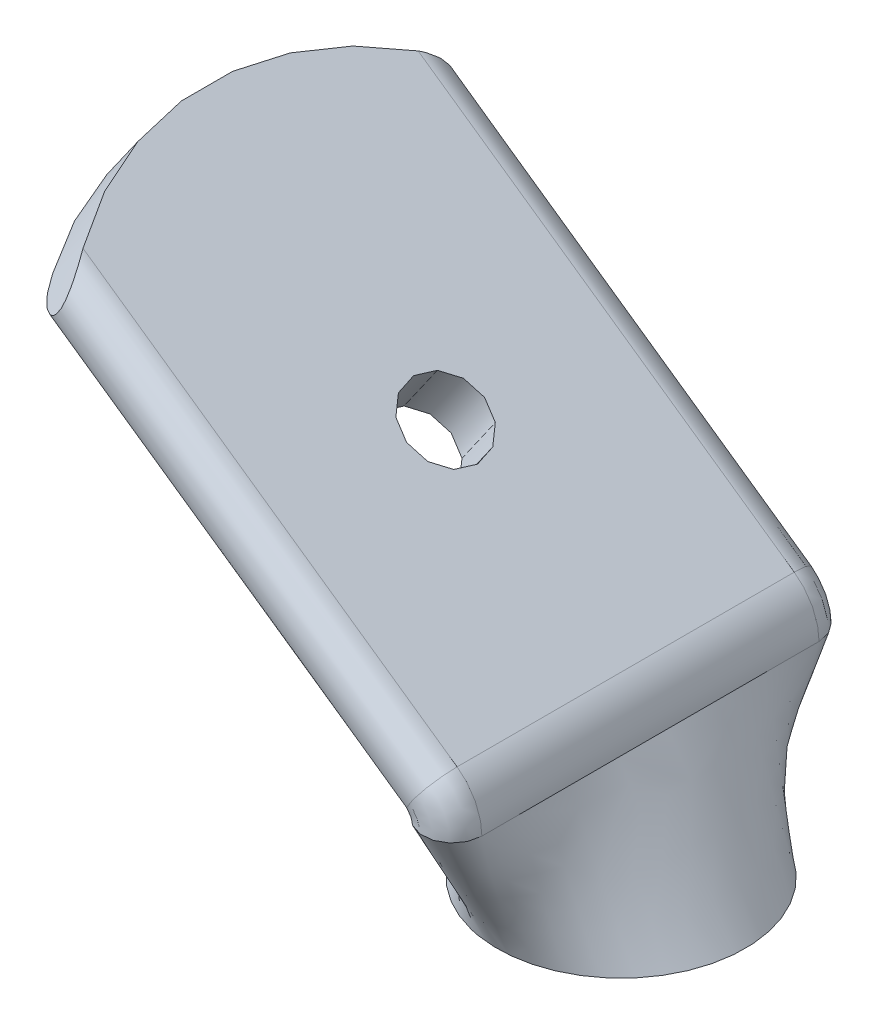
SolidWorks part; units mm, degrees
ref_plane "Front Plane" through (0, 0, 0) normal (0, 0, 1) x (1, 0, 0)
ref_plane "Top Plane" through (0, 0, 0) normal (0, 1, 0) x (1, 0, 0)
ref_plane "Right Plane" through (0, 0, 0) normal (1, 0, 0) x (0, 0, -1)
sketch "Sketch1" plane through (0, 0, 0) normal (0, 1, 0) x (1, 0, 0)
  circle A0 centre (0, 0) radius 10.7315
  dimension "D1" = 21.463
sketch "Sketch3" plane through (0, 0, 0) normal (0, 0, 1) x (1, 0, 0)
  spline S0 degree 3 poles (0, 0) (0, 1.9233) (0, 4.3754) (0, 7.5046) (0, 9.4654) (0, 10.8973) (0, 11.6523) knots 0 0 0 0 0.495171 0.631329 0.805623 1 1 1 1
ref_plane "Plane1" through (0, 11.6523, 0) normal (0, 1, 0) x (0, 0, 1)
sketch "Sketch4" plane through (0, 11.6523, 0) normal (0, 1, 0) x (0, 0, 1)
  line L0 (-14.605, 2.54) -> (14.605, 2.54)
  line L1 (-14.605, -2.54) -> (14.605, -2.54)
  arc A0 (14.605, 2.54) -> (14.605, -2.54) centre (14.605, 0) cw
  arc A1 (-14.605, 2.54) -> (-14.605, -2.54) centre (-14.605, 0) ccw
  dimension "D2" = 29.21
  dimension "D1" = 5.08
  dimension "D3" = 2.54
loft "Loft2" add profiles "Sketch1", "Sketch4"
sketch "Sketch15" plane through (0, 11.6523, 0) normal (0, 1, 0) x (-1, 0, 0)
  line L0 (2.4945, -18.0461) -> (2.4945, 19.3149) construction
revolve "Revolve6" add sketch "Sketch15" angle 55 about L0
sketch "Sketch20" plane through (-7.1486, 5.0055, 0) normal (-0.8192, 0.5736, 0) x (-0.5736, -0.8192, 0)
  line L2 (-8.1142, -15.0851) -> (-8.1142, 15.0849)
  line L3 (-13.1487, 14.605) -> (-13.1487, -14.605)
  line L4 (-8.1142, -15.0851) -> (-8.1142, 15.0849)
  line L5 (-13.1487, 14.605) -> (-13.1487, -14.605)
  spline S2 degree 2 poles (1931.9125, 449.0554) (-31.3725, 32.1117) (-12.978, -15.5212) (-12.8074, -15.9629) (-12.4883, -16.3141) (-12.1699, -16.6646) (-11.7455, -16.8771) (-11.3222, -17.0891) (-10.8498, -17.1342) (-10.3784, -17.1793) (-9.9215, -17.051) (-9.4657, -16.923) (-9.0858, -16.6386) (-8.7068, -16.3548) (-8.4551, -15.9525) (18.5777, 27.2524) (-1825.1952, 819.4445) knots -13.340293 -13.340293 -13.340293 0.125 0.125 0.25 0.25 0.375 0.375 0.5 0.5 0.625 0.625 0.75 0.75 0.875 0.875 14.329966 14.329966 14.329966 only from (-13.1487, -14.605) to (-8.1142, -15.0851)
  spline S3 degree 2 poles (-1830.5219, -807.759) (18.6088, -27.3466) (-8.455, 15.9523) (-8.706, 16.3538) (-9.0857, 16.6384) (-9.4646, 16.9224) (-9.9215, 17.0509) (-10.3773, 17.1791) (-10.8497, 17.1342) (-11.321, 17.0893) (-11.7455, 16.877) (-12.1689, 16.6652) (-12.4882, 16.3141) (-12.8068, 15.9638) (-12.978, 15.5212) (-31.3597, -32.0134) (1928.8885, -461.5364) knots -13.340309 -13.340309 -13.340309 0.125 0.125 0.25 0.25 0.375 0.375 0.5 0.5 0.625 0.625 0.75 0.75 0.875 0.875 14.329981 14.329981 14.329981 only from (-8.1142, 15.0849) to (-13.1487, 14.605)
  spline S4 degree 2 poles (-13.1487, -14.605) (-13.1487, -15.079) (-12.978, -15.5212) (-12.8074, -15.9629) (-12.4883, -16.3141) (-12.1699, -16.6646) (-11.7455, -16.8771) (-11.3222, -17.0891) (-10.8498, -17.1342) (-10.3784, -17.1793) (-9.9215, -17.051) (-9.4657, -16.923) (-9.0858, -16.6386) (-8.7068, -16.3548) (-8.4551, -15.9525) (-8.2039, -15.5511) (-8.1142, -15.0851) knots 0 0 0 0.125 0.125 0.25 0.25 0.375 0.375 0.5 0.5 0.625 0.625 0.75 0.75 0.875 0.875 1 1 1
  spline S5 degree 2 poles (-8.1142, 15.0849) (-8.2038, 15.5504) (-8.455, 15.9523) (-8.706, 16.3538) (-9.0857, 16.6384) (-9.4646, 16.9224) (-9.9215, 17.0509) (-10.3773, 17.1791) (-10.8497, 17.1342) (-11.321, 17.0893) (-11.7455, 16.877) (-12.1689, 16.6652) (-12.4882, 16.3141) (-12.8068, 15.9638) (-12.978, 15.5212) (-13.1487, 15.0796) (-13.1487, 14.605) knots 0 0 0 0.125 0.125 0.25 0.25 0.375 0.375 0.5 0.5 0.625 0.625 0.75 0.75 0.875 0.875 1 1 1
  dimension "D1" = 0
extrude "Extrude1" add sketch "Sketch20" along normal blind 44.45
sketch "Sketch23" plane through (4.6541, 6.6468, 0) normal (-0.5736, -0.8192, 0) x (0.8192, -0.5736, 0)
  line L0 (-8.7268, -15.0851) -> (-8.7268, 15.0849) construction
  line L1 (-37.0178, -23.0775) -> (-57.6262, -23.0775)
  line L2 (-57.6262, -23.0775) -> (-57.6262, 22.7967)
  line L3 (-57.6262, 22.7967) -> (-37.0178, 22.7967)
  arc A0 (-37.0178, -23.0775) -> (-37.0178, 22.7967) centre (-28.9706, -0.1404) cw
  dimension "D1" = 24.3078
  dimension "D2" = 20.2438
extrude "Cut-Extrude1" cut sketch "Sketch23" against normal through all
sketch "Sketch24" plane through (4.6541, 6.6468, 0) normal (-0.5736, -0.8192, 0) x (0.8192, -0.5736, 0)
  line L0 (-53.1768, -2.3605) -> (-53.1768, 2.0797) construction
  circle A0 centre (-27.7768, 0) radius 3.3782
  dimension "D1" = 25.4
extrude "Cut-Extrude2" cut sketch "Sketch24" against normal through all
